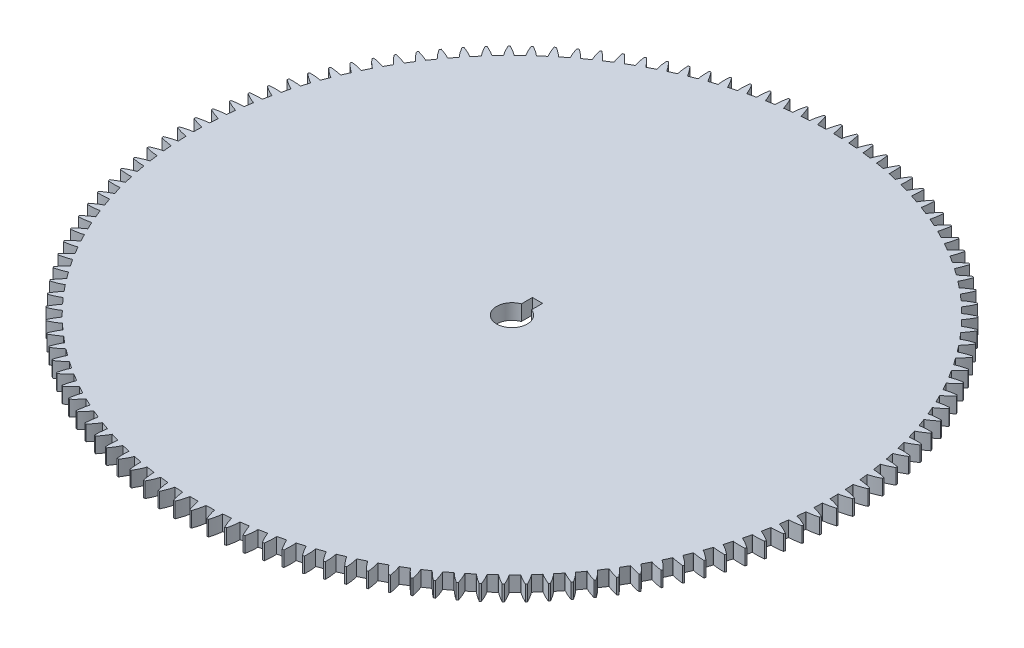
SolidWorks part; units mm, degrees
ref_plane "Front Plane" through (0, 0, 0) normal (0, 0, 1) x (1, 0, 0)
ref_plane "Top Plane" through (0, 0, 0) normal (0, 1, 0) x (1, 0, 0)
ref_plane "Right Plane" through (0, 0, 0) normal (1, 0, 0) x (0, 0, -1)
sketch "Sketch1" plane through (0, 0, 0) normal (0, 1, 0) x (1, 0, 0)
  line L0 (0, 0) -> (0, 30.7387) construction
  line L1 (0, 0) -> (-30.7387, 0) construction
  line L2 (0, 0) -> (-32.2475, -0.3989) construction
  line L3 (0, 0) -> (-30.7293, -0.7603) construction
  line L4 (0, 0) -> (-30.7011, -1.5201) construction
  circle A0 centre (0, 0) radius 31.75 construction
  circle A1 centre (0, 0) radius 30.7387 construction
  circle A2 centre (0, 0) radius 31.125 construction
  circle A3 centre (0, 0) radius 32.25 construction
  spline S0 degree 4 poles (-30.7387, 0) (-30.7811, 0) (-30.8999, -0.0044) (-31.1237, -0.0298) (-31.4854, -0.0956) (-31.9395, -0.2146) (-32.5154, -0.4084) (-33.1769, -0.6866) (-33.8824, -1.0437) (-34.6235, -1.4854) (-35.3366, -1.9721) (-36.0212, -2.4981) (-36.6776, -3.0588) (-37.4401, -3.777) (-38.3075, -4.696) (-39.2474, -5.8392) (-40.222, -7.2271) (-41.1101, -8.7085) (-41.8961, -10.2464) (-42.4966, -11.6329) (-42.9506, -12.8457) (-43.2892, -13.8697) (-43.5366, -14.697) (-43.8167, -15.7378) (-44.0588, -16.791) (-44.2632, -17.8477) (-44.4647, -19.1307) (-44.5961, -20.1934) (-44.6831, -21.1751) (-44.735, -22.0146) (-44.7644, -22.6802) (-44.7778, -23.1293) (-44.7917, -23.9248) (-44.7835, -24.5158) (-44.7735, -25.1501) (-44.7582, -25.4483) (-44.7513, -25.6537) knots 0 0 0 0 0 0.005377 0.015084 0.028532 0.04661 0.064855 0.092111 0.119476 0.146842 0.174209 0.201575 0.228941 0.256307 0.307035 0.361767 0.4165 0.471232 0.525964 0.580697 0.608063 0.635429 0.662795 0.690161 0.744894 0.77226 0.799626 0.854358 0.881725 0.895408 0.909091 0.931818 0.954545 0.977273 1 1 1 1 1 construction
  spline S1 degree 4 poles (-30.7387, 0) (-30.7811, 0) (-30.8999, -0.0044) (-31.1237, -0.0298) (-31.4854, -0.0956) (-31.9395, -0.2146) (-32.5154, -0.4084) (-33.1769, -0.6866) (-33.8824, -1.0437) (-34.6235, -1.4854) (-35.3366, -1.9721) (-36.0212, -2.4981) (-36.6776, -3.0588) (-37.4401, -3.777) (-38.3075, -4.696) (-39.2474, -5.8392) (-40.222, -7.2271) (-41.1101, -8.7085) (-41.8961, -10.2464) (-42.4966, -11.6329) (-42.9506, -12.8457) (-43.2892, -13.8697) (-43.5366, -14.697) (-43.8167, -15.7378) (-44.0588, -16.791) (-44.2632, -17.8477) (-44.4647, -19.1307) (-44.5961, -20.1934) (-44.6831, -21.1751) (-44.735, -22.0146) (-44.7558, -22.4849) (-44.7632, -22.6838) (-44.7665, -22.7818) knots 0 0 0 0 0 0.005377 0.015084 0.028532 0.04661 0.064855 0.092111 0.119476 0.146842 0.174209 0.201575 0.228941 0.256307 0.307035 0.361767 0.4165 0.471232 0.525964 0.580697 0.608063 0.635429 0.662795 0.690161 0.744894 0.77226 0.799626 0.854358 0.881725 0.895408 0.909091 0.909091 0.909091 0.909091 0.909091
  dimension "D1" = 64.5
  dimension "D2" = 63.5
  dimension "D3" = 61.4774
  dimension "D4" = 62.25
  dimension "D5" = 30.7387
  dimension "D6" = 0.709
  dimension "D7" = 1.417
  dimension "D8" = 2.835
sketch "Sketch2" plane through (0, 0, 0) normal (0, 1, 0) x (1, 0, 0)
  line L0 (0, 0) -> (-32.2475, -0.3989) construction
  line L1 (0, 0) -> (-32.2475, -0.3989) construction
  line L2 (0, 0) -> (-30.7293, -0.7603) construction
  line L3 (0, 0) -> (-30.7387, 0) construction
  line L4 (0, 0) -> (-30.7011, -1.5201) construction
  line L5 (0, 0) -> (-30.7293, -0.7603) construction
  line L6 (0, 0) -> (-30.7387, 0) construction
  line L7 (0, 0) -> (-30.7011, -1.5201) construction
  line L8 (-31.125, 0) -> (-31.1155, -0.7699) construction
  line L9 (-31.1155, -0.7699) -> (-31.0869, -1.5392)
  line L10 (-31.0869, -1.5392) -> (-30.7011, -1.5201) construction
  line L11 (-31.0869, -1.5392) -> (-1.4982, -0.0742)
  line L12 (-30.7387, 0) -> (-1.5, 0)
  line L13 (-30.7387, 0) -> (-31.125, 0)
  line L14 (-31.125, 0) -> (-31.1246, -0.0343)
  circle A0 centre (0, 0) radius 31.125 construction
  circle A1 centre (0, 0) radius 30.7387 construction
  circle A2 centre (0, 0) radius 31.75 construction
  circle A3 centre (0, 0) radius 32.25 construction
  circle A4 centre (0, 0) radius 31.125 construction
  circle A5 centre (0, 0) radius 30.7387 construction
  circle A6 centre (0, 0) radius 31.75 construction
  circle A7 centre (0, 0) radius 32.25 construction
  arc A8 (-32.2465, -0.4755) -> (-32.2484, -0.3222) centre (0, 0) cw
  circle A11 centre (0, 0) radius 1.5 construction
  arc A12 (-1.5, 0) -> (-1.4982, -0.0742) centre (0, 0) ccw
  spline S0 degree 4 poles (-86.8315, -1999.0537) (-24.3668, -49.1547) (-25.9388, -1.1031) (-28.8004, 0.3928) (-31.4854, -0.0956) (-31.9395, -0.2146) (-32.5154, -0.4084) (-33.1769, -0.6866) (-33.8824, -1.0437) (-34.6235, -1.4854) (-35.3366, -1.9721) (-36.0212, -2.4981) (-36.6776, -3.0588) (-37.4401, -3.777) (-38.3075, -4.696) (-39.2474, -5.8392) (-40.222, -7.2271) (-41.1101, -8.7085) (-41.8961, -10.2464) (-42.4966, -11.6329) (-42.9506, -12.8457) (-43.2892, -13.8697) (-43.5366, -14.697) (-43.8167, -15.7378) (-44.0588, -16.791) (-44.2632, -17.8477) (-44.4647, -19.1307) (-44.5961, -20.1934) (-44.6831, -21.1751) (-44.8582, -24.0066) (-44.8357, -28.0885) (-42.8076, 23.2992) (-110.3696, -2021.5683) knots -0.299399 -0.299399 -0.299399 -0.299399 -0.299399 0.005377 0.015084 0.028532 0.04661 0.064855 0.092111 0.119476 0.146842 0.174209 0.201575 0.228941 0.256307 0.307035 0.361767 0.4165 0.471232 0.525964 0.580697 0.608063 0.635429 0.662795 0.690161 0.744894 0.77226 0.799626 0.854358 0.881725 0.895408 1.168842 1.168842 1.168842 1.168842 1.168842 only from (-30.7387, 0) to (-44.7665, -22.7818) construction
  spline S1 degree 4 poles (-31.1246, -0.0343) (-31.1463, -0.0376) (-31.2727, -0.0576) (-31.5383, -0.1094) (-31.8195, -0.1832) (-32.0758, -0.2633) (-32.2295, -0.3157) (-32.2484, -0.3222) knots 0.012297 0.012297 0.012297 0.012297 0.012297 0.015084 0.028532 0.04661 0.049138 0.049138 0.049138 0.049138 0.049138
  spline S2 degree 4 poles (-31.1155, -0.7699) (-31.123, -0.7689) (-31.2078, -0.7582) (-31.3986, -0.7253) (-31.6839, -0.6592) (-31.9571, -0.5767) (-32.1531, -0.5094) (-32.2465, -0.4755) knots 0.004428 0.004428 0.004428 0.004428 0.004428 0.005377 0.015084 0.028532 0.040915 0.040915 0.040915 0.040915 0.040915
  point P18 (-31.1202, -0.3849)
  point P24 (-31.0869, -1.5392)
  dimension "D2" = 3
extrude "Boss-Extrude1" add sketch "Sketch2" along normal blind 1.5
pattern_circular "CirPattern1" count 127 over 360 of "Boss-Extrude1"
sketch "Sketch3" plane through (0, 1.5, 0) normal (0, 1, 0) x (1, 0, 0)
  line L1 (0.5, 0.5) -> (-0.5, 0.5)
  line L2 (0.5, 0.5) -> (0.5, 2.5)
  line L3 (0.5, 2.5) -> (-0.5, 2.5)
  line L4 (-0.5, 0.5) -> (-0.5, 2.5)
  line L5 (0.5, 0.5) -> (-0.5, 2.5) construction
  line L6 (0.5, 2.5) -> (-0.5, 0.5) construction
  circle A0 centre (0, 0) radius 1.5 construction
  point P0 (0, 1.5)
  dimension "D1" = 2
  dimension "D2" = 1
extrude "Cut-Extrude1" cut sketch "Sketch3" against normal up to surface (1.5 mm away)
equation "\"Module\"= .5"
equation "\"Number of Teeth\" = 127"
equation "\"Pressure Angle\"= 14.5deg"
equation "\"Pitch Diameter\"= \"Number of Teeth\" * \"Module\""
equation "\"Circular Pitch\"= pi * \"Module\""
equation "\"Addendum\"= \"Module\""
equation "\"Dedendum\"= 1.25 * \"Module\""
equation "\"Base Diameter\"= \"Pitch Diameter\" * cos ( \"Pressure Angle\" )"
equation "\"Base Radius\"= \"Base Diameter\" / 2"
equation "\"Width\"= 1.5mm"
equation "\"Outside Diameter\"= \"Pitch Diameter\" + 2 * \"Addendum\""
equation "\"D1@Sketch1\"=\"Outside Diameter\""
equation "\"D3@Sketch1\"=\"Base Diameter\""
equation "\"Root Diameter\"= \"Pitch Diameter\" - 2 * \"Dedendum\""
equation "\"D4@Sketch1\"=\"Root Diameter\""
equation "\"Tooth Angle\"= 360 / \"Number of Teeth\""
equation "\"D6@Sketch1\"=\"Tooth Angle\"/4"
equation "\"D7@Sketch1\"=\"Tooth Angle\"/2"
equation "\"D8@Sketch1\"=\"Tooth Angle\""
equation "\"D2@Sketch1\" = \"Pitch Diameter\""
equation "\"Shaft Diameter\"= 3mm"
equation "\"D1@CirPattern1\" = \"Number of Teeth\""
equation "\"D2@Sketch2\"  = \"Shaft Diameter\""
equation "\"D1@Boss-Extrude1\" = \"Width\""
